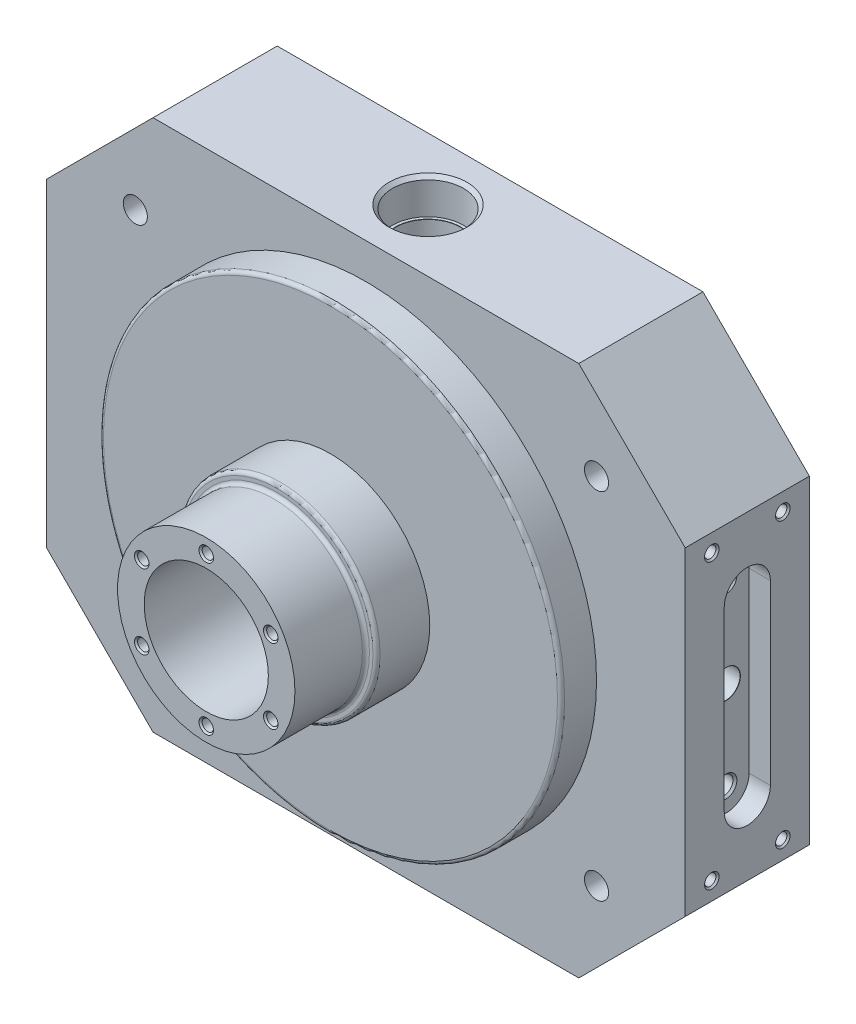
SolidWorks part; units mm, degrees
ref_plane "Front Plane" through (0, 0, 0) normal (0, 0, 1) x (1, 0, 0)
ref_plane "Top Plane" through (0, 0, 0) normal (0, 1, 0) x (1, 0, 0)
ref_plane "Right Plane" through (0, 0, 0) normal (1, 0, 0) x (0, 0, -1)
sketch "Sketch1" plane through (0, 0, 0) normal (0, 0, 1) x (1, 0, 0)
  line L0 (30, -37.5) -> (45, -22.5)
  line L1 (-30, 37.5) -> (30, 37.5)
  line L2 (-45, 22.5) -> (-45, -22.5)
  line L3 (-30, -37.5) -> (30, -37.5)
  line L4 (45, 22.5) -> (45, -22.5)
  line L5 (-45, 37.5) -> (45, -37.5) construction
  line L6 (-45, -37.5) -> (45, 37.5) construction
  line L7 (30, 37.5) -> (45, 22.5)
  line L8 (-45, 22.5) -> (-30, 37.5)
  line L9 (-45, -22.5) -> (-30, -37.5)
  point P0 (0, 0)
  dimension "D1" = 90
  dimension "D2" = 75
  dimension "D3" = 15
  dimension "D4" = 45
  dimension "D5" = 15
  dimension "D6" = 45
  dimension "D7" = 15
  dimension "D8" = 45
  dimension "D9" = 15
  dimension "D10" = 45
extrude "Boss-Extrude1" add sketch "Sketch1" along normal blind 17.5
sketch "Sketch2" plane through (0, 0, 17.5) normal (0, 0, 1) x (1, 0, 0)
  circle A0 centre (0, 0) radius 32.5
  dimension "D1" = 65
extrude "Boss-Extrude2" add sketch "Sketch2" along normal blind 5
sketch "Sketch3" plane through (0, 0, 22.5) normal (0, 0, 1) x (1, 0, 0)
  circle A0 centre (0, 0) radius 14
  dimension "D1" = 28
extrude "Boss-Extrude3" add sketch "Sketch3" along normal blind 7.5
sketch "Sketch4" plane through (0, 0, 30) normal (0, 0, 1) x (1, 0, 0)
  circle A0 centre (0, 0) radius 12.5
  dimension "D1" = 25
extrude "Boss-Extrude4" add sketch "Sketch4" along normal blind 10
sketch "Sketch5" plane through (0, 0, 40) normal (0, 0, 1) x (1, 0, 0)
  circle A0 centre (0, 0) radius 8.75
  dimension "D1" = 17.5
extrude "Cut-Extrude3" cut sketch "Sketch5" against normal through all
fillet "Fillet2" radius 0.5 1 edges at (32.5, 0, 22.5)
fillet "Fillet3" radius 0.5 2 edges at (12.5, 0, 30) (14, 0, 30)
hole_wizard "CBORE for M3 Pan Head Machine Screw1" positions "Sketch7" profile "Sketch8" counterbore size "M3" standard "ANSI Metric"
sketch "Sketch7" plane through (0, 0, 0) normal (0, 0, 1) x (1, 0, 0)
  line L0 (0, 0) -> (-45, 0) construction
  line L1 (-45, 22.5) -> (-45, -22.5) construction
  line L2 (0, 0) -> (0, -37.5) construction
  line L3 (-30, -37.5) -> (30, -37.5) construction
  point P0 (-32.5, -25)
  point P16 (-32.5, 25)
  point P18 (32.5, -25)
  point P19 (32.5, 25)
  dimension "D1" = 25
  dimension "D2" = 32.5
sketch "Sketch8" plane through (-32.5, -25, 0) normal (1, 0, 0) x (0, 1, 0)
  line L0 (0, 0) -> (0, 17.5)
  line L1 (0, 17.5) -> (1.7, 17.5)
  line L3 (1.7, 17.5) -> (1.7, 2.4)
  line L4 (3.5, 2.4) -> (1.7, 2.4)
  line L5 (3.5, 2.4) -> (3.5, 0.025)
  line L6 (3.5, 0.025) -> (3.525, 0)
  line L7 (3.525, 0) -> (0, 0)
  line L8 (-3.5, 0.025) -> (-3.525, 0) construction
  line L11 (0, -6.35) -> (0, 107.95) construction
  dimension "Thru Hole Dia." = 3.4
  dimension "Thru Hole Depth" = 17.5
  dimension "C'Bore Dia." = 7
  dimension "C'Bore Depth" = 2.4
  dimension "Near C'Sink Dia." = 7.05
  dimension "Near C'Sink Angle" = 90
hole_wizard "M2x0.4 Tapped Hole1" positions "Sketch9" profile "Sketch10" tap size "M2x0.4" standard "ANSI Metric"
sketch "Sketch9" plane through (0, 0, 40) normal (0, 0, 1) x (1, 0, 0)
  line L0 (0, 0) -> (0, 10.5) construction
  point P0 (0, 10.5)
  point P32 (9.0933, 5.25)
  point P33 (9.0933, -5.25)
  point P34 (0, -10.5)
  point P35 (-9.0933, -5.25)
  point P36 (-9.0933, 5.25)
  dimension "D1" = 10.5
sketch "Sketch10" plane through (0, 10.5, 40) normal (1, 0, 0) x (0, -1, 0)
  line L0 (0, 0) -> (0, 6.4807)
  line L1 (0, 6.4807) -> (0.8, 6)
  line L2 (0.8, 6) -> (0.8, 0.225)
  line L3 (0.8, 0.225) -> (1.025, 0)
  line L5 (1.025, 0) -> (0, 0)
  line L6 (-0.8, 0.225) -> (-1.025, 0) construction
  line L10 (0, 6.4807) -> (-0.8, 6) construction
  line L11 (0, -6.35) -> (0, 107.95) construction
  dimension "Tap Drill Dia." = 1.6
  dimension "Tap Drill Depth" = 6
  dimension "Near C'Sink Dia." = 2.05
  dimension "Near C'Sink Angle" = 90
  dimension "Drill Angle" = 118
sketch "Sketch11" plane through (-45, 0, 0) normal (-1, 0, 0) x (0, 0, 1)
  line L0 (0, 0) -> (17.5, 0) construction
  line L1 (17.5, -32.5) -> (17.5, 32.5) construction
  line L2 (8.75, -12.5) -> (8.75, 12.5) construction
  line L3 (5.5, -12.5) -> (5.5, 12.5)
  line L4 (12, -12.5) -> (12, 12.5)
  arc A0 (5.5, -12.5) -> (12, -12.5) centre (8.75, -12.5) ccw
  arc A1 (12, 12.5) -> (5.5, 12.5) centre (8.75, 12.5) ccw
  point P7 (8.75, 0)
  dimension "D1" = 3.25
  dimension "D2" = 25
extrude "Cut-Extrude5" cut sketch "Sketch11" against normal blind 3
hole_wizard "M3x0.5 Tapped Hole1" positions "Sketch12" profile "Sketch13" tap size "M3x0.5" standard "ANSI Metric"
sketch "Sketch12" plane through (-42, 0, 0) normal (-1, 0, 0) x (0, 0, 1)
  point P0 (8.75, -12.5)
  point P3 (8.75, 12.5)
sketch "Sketch13" plane through (-42, -12.5, 8.75) normal (0, 1, 0) x (0, 0, 1)
  line L0 (0, 0) -> (0, 9.2511)
  line L1 (0, 9.2511) -> (1.25, 8.5)
  line L2 (1.25, 8.5) -> (1.25, 0.275)
  line L3 (1.25, 0.275) -> (1.525, 0)
  line L5 (1.525, 0) -> (0, 0)
  line L6 (-1.25, 0.275) -> (-1.525, 0) construction
  line L10 (0, 9.2511) -> (-1.25, 8.5) construction
  line L11 (0, -6.35) -> (0, 107.95) construction
  dimension "Tap Drill Dia." = 2.5
  dimension "Tap Drill Depth" = 8.5
  dimension "Near C'Sink Dia." = 3.05
  dimension "Near C'Sink Angle" = 90
  dimension "Drill Angle" = 118
hole_wizard "Ø4.0mm Dowel Hole1" positions "Sketch14" profile "Sketch15" hole size "Ø4.0" standard "ANSI Metric"
sketch "Sketch14" plane through (-42, 0, 0) normal (-1, 0, 0) x (0, 0, 1)
  line L0 (5.5, 0) -> (12, 0) construction
  line L1 (5.5, 12.5) -> (5.5, -12.5) construction
  line L2 (12, -12.5) -> (12, 12.5) construction
  point P8 (8.75, 0)
sketch "Sketch15" plane through (-42, 0, 8.75) normal (0, 1, 0) x (0, 0, 1)
  line L0 (0, 0) -> (0, 18.2017)
  line L1 (0, 18.2017) -> (2, 17)
  line L2 (2, 17) -> (2, 0.025)
  line L3 (2, 0.025) -> (2.025, 0)
  line L5 (2.025, 0) -> (0, 0)
  line L6 (-2, 0.025) -> (-2.025, 0) construction
  line L10 (0, 18.2017) -> (-2, 17) construction
  line L11 (0, -6.35) -> (0, 107.95) construction
  dimension "Hole Dia." = 4
  dimension "Hole Depth" = 17
  dimension "Near C'Sink Dia." = 4.05
  dimension "Near C'Sink Angle" = 90
  dimension "Drill Angle" = 118
hole_wizard "M2x0.4 Tapped Hole2" positions "Sketch18" profile "Sketch17" tap size "M2x0.4" standard "ANSI Metric"
sketch "Sketch18" plane through (-45, 0, 0) normal (-1, 0, 0) x (0, 0, 1)
  line L0 (0, 0) -> (17.5, 0) construction
  line L1 (17.5, 22.5) -> (17.5, -22.5) construction
  line L2 (8.75, 0) -> (8.75, 22.5) construction
  line L3 (17.5, 22.5) -> (0, 22.5) construction
  point P0 (3.75, -20)
  point P15 (3.75, 20)
  point P17 (13.75, -20)
  point P18 (13.75, 20)
  dimension "D1" = 20
  dimension "D2" = 5
sketch "Sketch17" plane through (-45, -20, 3.75) normal (0, 1, 0) x (0, 0, 1)
  line L0 (0, 0) -> (0, 6.4807)
  line L1 (0, 6.4807) -> (0.8, 6)
  line L2 (0.8, 6) -> (0.8, 0.225)
  line L3 (0.8, 0.225) -> (1.025, 0)
  line L5 (1.025, 0) -> (0, 0)
  line L6 (-0.8, 0.225) -> (-1.025, 0) construction
  line L10 (0, 6.4807) -> (-0.8, 6) construction
  line L11 (0, -6.35) -> (0, 107.95) construction
  dimension "Tap Drill Dia." = 1.6
  dimension "Tap Drill Depth" = 6
  dimension "Near C'Sink Dia." = 2.05
  dimension "Near C'Sink Angle" = 90
  dimension "Drill Angle" = 118
mirror "Mirror1" about plane through (0, 0, 0) normal (1, 0, 0) of "M2x0.4 Tapped Hole2", "Ø4.0mm Dowel Hole1", "M3x0.5 Tapped Hole1", "Cut-Extrude5"
sketch "Sketch19" plane through (0, -37.5, 0) normal (0, -1, 0) x (1, 0, 0)
  line L0 (0, 17.5) -> (0, 0) construction
  line L1 (-30, 17.5) -> (30, 17.5) construction
  circle A0 centre (0, 8.75) radius 5
  dimension "D1" = 10
extrude "Cut-Extrude6" cut sketch "Sketch19" against normal blind 5
chamfer "Chamfer1" distance 0.5 angle 45 1 edges at (0, -37.5, 3.75)
hole_wizard "1/8 Rc Tapped Hole1" positions "Sketch21" profile "Sketch22" size "1/8" standard "DIN"
sketch "Sketch21" plane through (0, -32.5, 0) normal (0, -1, 0) x (-1, 0, 0)
  point P0 (0, -8.75)
sketch "Sketch22" plane through (0, -32.5, 8.75) normal (1, 0, 0) x (0, 0, -1)
  line L0 (0, 0) -> (0, 23.75)
  line L1 (0, 23.75) -> (3.95, 23.75)
  line L3 (3.95, 23.75) -> (3.95, 7.4)
  line L4 (3.95, 7.4) -> (4.3433, 7.4)
  line L5 (4.3433, 7.4) -> (4.5735, 0.025)
  line L6 (4.5735, 0.025) -> (4.5985, 0)
  line L7 (4.5985, 0) -> (0, 0)
  line L8 (0, -6.35) -> (0, 107.95) construction
  line L9 (-4.5735, 0.025) -> (-4.5985, 0) construction
  line L11 (-3.95, 7.4) -> (-4.3433, 7.4) construction
  line L12 (-4.3433, 7.4) -> (-4.5735, 0.025) construction
  dimension "Thru Tap Drill Dia." = 7.9
  dimension "Thru Tap Drill Depth" = 23.75
  dimension "Thread Dia." = 9.147
  dimension "Thread Angle" = 3.576
  dimension "Thread Depth" = 7.4
  dimension "Near C'Sink Dia." = 9.197
  dimension "Near C'Sink Angle" = 90
mirror "Mirror5" about plane through (0, 0, 0) normal (0, 1, 0) of "1/8 Rc Tapped Hole1", "Chamfer1", "Cut-Extrude6"
scale "Scale1" scale about centroid uniform scaling yes scale factor 1.33
